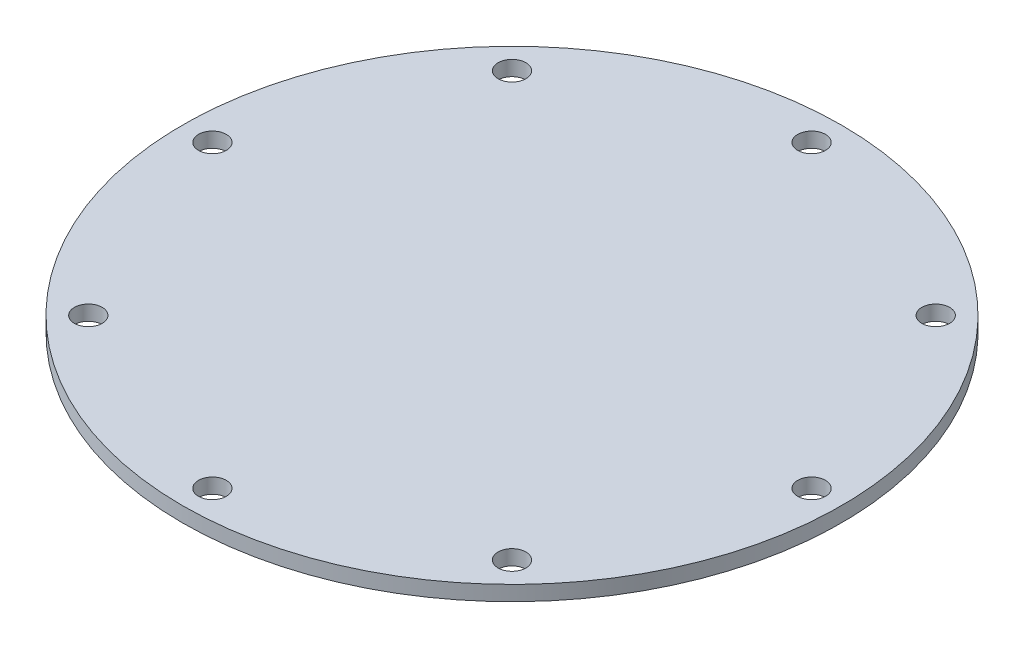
SolidWorks part; units mm, degrees
ref_plane "Front Plane" through (0, 0, 0) normal (0, 0, 1) x (1, 0, 0)
ref_plane "Top Plane" through (0, 0, 0) normal (0, 1, 0) x (1, 0, 0)
ref_plane "Right Plane" through (0, 0, 0) normal (1, 0, 0) x (0, 0, -1)
sketch "Sketch1" plane through (0, 0, 0) normal (0, 0, 1) x (1, 0, 0)
  line L0 (0, 0) -> (0, 104.8616) construction
  line L1 (0, 0) -> (-34.925, 0)
  line L3 (-34.925, 0) -> (-34.925, 1.5875)
  line L4 (-34.925, 1.5875) -> (0, 1.5875)
  line L5 (0, 1.5875) -> (0, 0)
  dimension "D2" = 69.85
  dimension "D3" = 1.5875
revolve "Revolve1" add sketch "Sketch1" angle 360 about L0
hole_wizard "#4 Clearance Hole1" positions "Sketch3" profile "Sketch2" hole size "#4" standard "ANSI Inch"
sketch "Sketch3" plane through (0, 1.5875, 0) normal (0, 1, 0) x (1, 0, 0)
  line L0 (-31.75, 0) -> (0, 0) construction
  circle A0 centre (0, 0) radius 31.75 construction
  circle A1 centre (-31.75, 0) radius 3.2991 construction
  point P0 (-31.75, 0)
sketch "Sketch2" plane through (-31.75, 1.5875, 0) normal (1, 0, 0) x (0, 0, 1)
  line L0 (0, 0) -> (0, 1.5875)
  line L1 (0, 1.5875) -> (1.4732, 1.5875)
  line L2 (1.4732, 1.5875) -> (1.4732, 0)
  line L5 (1.4732, 0) -> (0, 0)
  line L11 (0, -6.35) -> (0, 107.95) construction
  dimension "Thru Hole Dia." = 2.9464
  dimension "Thru Hole Depth" = 1.5875
pattern_circular "CirPattern1" count 8 over 360 about axis through (0, 0, 0) along (0, 1, 0) of "#4 Clearance Hole1"
